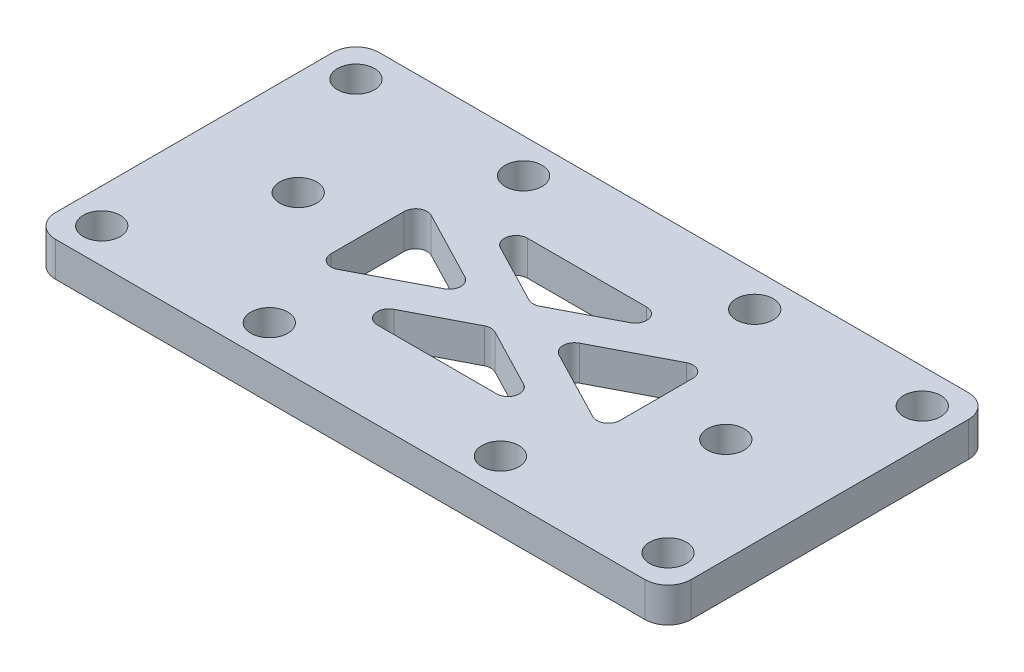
SolidWorks part; units mm, degrees
ref_plane "前视基准面" through (0, 0, 0) normal (0, 0, 1) x (1, 0, 0)
ref_plane "上视基准面" through (0, 0, 0) normal (0, 1, 0) x (1, 0, 0)
ref_plane "右视基准面" through (0, 0, 0) normal (1, 0, 0) x (0, 0, -1)
other "Configuration Table"
sketch "草图1" plane through (0, 0, 0) normal (0, 1, 0) x (1, 0, 0)
  line L1 (-27.5, -14) -> (27.5, -14)
  line L2 (-27.5, -14) -> (-27.5, 14)
  line L3 (-27.5, 14) -> (27.5, 14)
  line L4 (27.5, -14) -> (27.5, 14)
  line L5 (-27.5, -14) -> (27.5, 14) construction
  line L6 (-27.5, 14) -> (27.5, -14) construction
  circle A1 centre (0, 0) radius 8 construction
  circle A2 centre (8, 0) radius 1.6 construction
  circle A3 centre (0, -8) radius 1.6 construction
  circle A4 centre (-8, 0) radius 1.6 construction
  circle A5 centre (0, 8) radius 1.6 construction
  point P0 (0, 0)
  point P14 (0, 0)
  point P17 (0, 0)
  point P20 (0, 0)
  point P23 (0, 0)
  dimension "D4" = 16
  dimension "D5" = 3.2
  dimension "D1" = 28
  dimension "D2" = 55
  dimension "D6" = 4
extrude "凸台-拉伸1" add sketch "草图1" along normal blind 3
sketch "草图2" plane through (0, 3, 0) normal (0, 1, 0) x (1, 0, 0)
  line L8 (27.5, 14) -> (-27.5, 14) construction
  line L10 (-27.5, 14) -> (-27.5, -14) construction
  line L11 (0, 14) -> (0, -14) construction
  line L12 (-27.5, -14) -> (27.5, -14) construction
  line L14 (0, 0) -> (27.5, 0) construction
  line L15 (27.5, -14) -> (27.5, 14) construction
  line L16 (-9.2487, -6.5) -> (12.5, 4.8093)
  line L17 (-12.5, -6.5) -> (12.5, -6.5)
  line L18 (-12.5, -6.5) -> (-12.5, 6.5)
  line L19 (-12.5, 6.5) -> (12.5, 6.5)
  line L20 (12.5, -6.5) -> (12.5, 6.5)
  line L21 (-12.5, -6.5) -> (12.5, 6.5) construction
  line L22 (-12.5, 6.5) -> (12.5, -6.5) construction
  line L23 (-12.5, -4.8093) -> (9.2487, 6.5)
  line L24 (-12.5, 4.8093) -> (9.2487, -6.5)
  line L25 (-9.2487, 6.5) -> (12.5, -4.8093)
  line L27 (-13.192, 5.1692) -> (11.808, -7.8308) construction
  line L28 (-11.808, 7.8308) -> (13.192, -5.1692) construction
  line L29 (-11.808, -7.8308) -> (13.192, 5.1692) construction
  line L30 (-13.192, -5.1692) -> (11.808, 7.8308) construction
  circle A4 centre (-24.5, 11) radius 1.6
  circle A5 centre (-24.5, -11) radius 1.6
  circle A6 centre (24.5, 11) radius 1.6
  circle A7 centre (24.5, -11) radius 1.6
  point P0 (0, 0)
  dimension "D2" = 13
  dimension "D3" = 1.5
  dimension "D4" = 3.2
  dimension "D7" = 3
  dimension "D1" = 25
  dimension "D5" = 3
  dimension "D6" = 3
  dimension "D8" = 3
  dimension "D9" = 1.5
  dimension "D10" = 1.5
  dimension "D11" = 1.5
extrude "切除-拉伸1" cut sketch "草图2" against normal through all contours L24 L18 L23 | L24 L16 L17 | L16 L25 L20 | L19 L25 L23 | A4 | A5 | A7 | A6
fillet "圆角1" radius 2
fillet "圆角2" radius 1
sketch "草图3" plane through (0, 3, 0) normal (0, 1, 0) x (1, 0, 0)
  line L0 (0, -14) -> (0, 14) construction
  line L1 (-25.5, -14) -> (25.5, -14) construction
  line L2 (25.5, 14) -> (-25.5, 14) construction
  line L3 (-27.5, 0) -> (27.5, 0) construction
  line L4 (-27.5, 12) -> (-27.5, -12) construction
  line L5 (27.5, -12) -> (27.5, 12) construction
  line L6 (-24.5, -11) -> (24.5, -11) construction
  circle A0 centre (10, -11) radius 1.6
  circle A1 centre (-24.5, -11) radius 1.6 construction
  circle A2 centre (24.5, -11) radius 1.6 construction
  circle A3 centre (-24.5, -11) radius 1.6 construction
  circle A4 centre (24.5, -11) radius 1.6 construction
  circle A5 centre (-10, -11) radius 1.6
  circle A6 centre (10, 11) radius 1.6
  circle A7 centre (-10, 11) radius 1.6
  circle A8 centre (-24.5, 11) radius 2.75 construction
  circle A9 centre (18.5, 0) radius 1.6
  circle A10 centre (-18.5, 0) radius 1.6
  dimension "D1" = 3.2
  dimension "D2" = 22
  dimension "D3" = 20
  dimension "D4" = 5.5
  dimension "D5" = 3.2
  dimension "D6" = 9
extrude "切除-拉伸2" cut sketch "草图3" against normal through all
